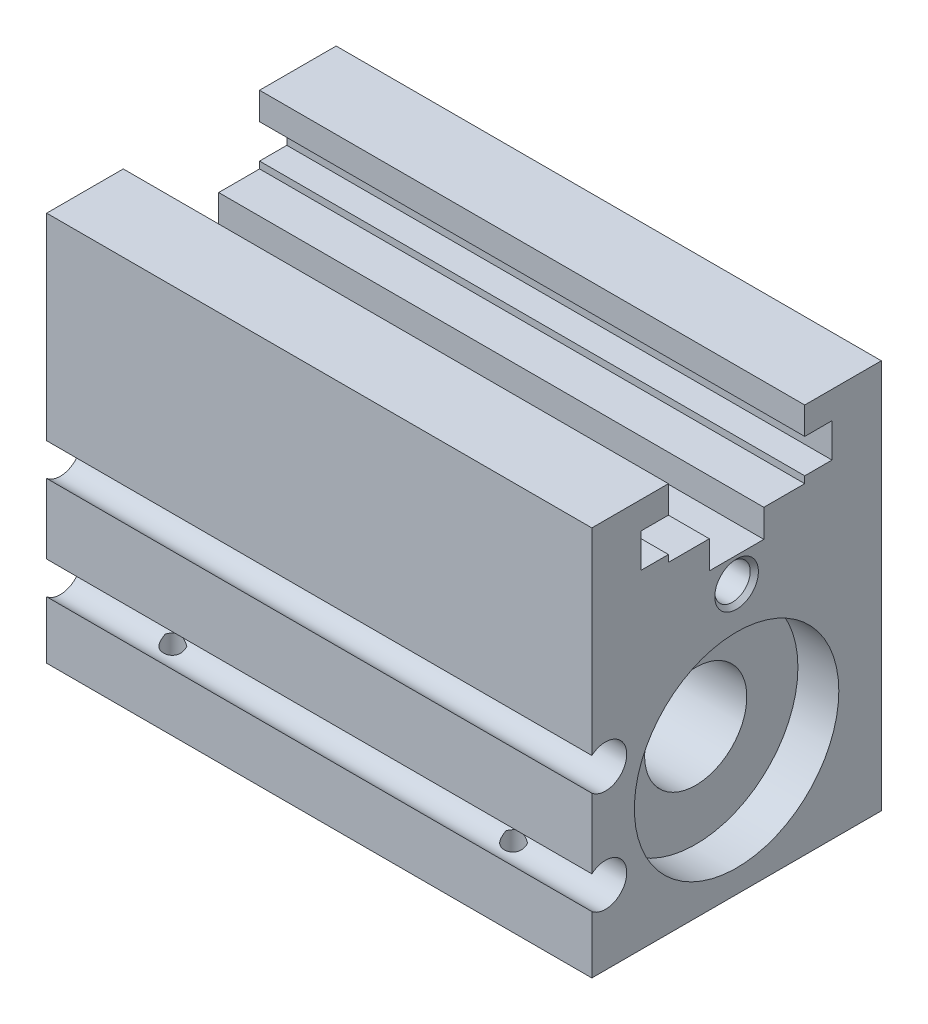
SolidWorks part; units mm, degrees
ref_plane "Front Plane" through (0, 0, 0) normal (0, 0, 1) x (1, 0, 0)
ref_plane "Top Plane" through (0, 0, 0) normal (0, 1, 0) x (1, 0, 0)
ref_plane "Right Plane" through (0, 0, 0) normal (1, 0, 0) x (0, 0, -1)
sketch "Sketch1" plane through (0, 0, 0) normal (1, 0, 0) x (0, 0, -1)
  line L0 (-13.4874, -18.161) -> (13.4874, -18.161)
  line L1 (13.4874, -18.161) -> (13.4874, 18.161)
  line L2 (13.4874, 18.161) -> (6.35, 18.161)
  line L3 (6.35, 18.161) -> (6.35, 15.621)
  line L4 (6.35, 15.621) -> (8.89, 15.621)
  line L5 (8.89, 15.621) -> (8.89, 12.446)
  line L6 (8.89, 12.446) -> (6.35, 12.446)
  line L7 (6.35, 12.446) -> (6.35, 11.811)
  line L8 (6.35, 11.811) -> (2.54, 11.811)
  line L9 (2.54, 11.811) -> (2.54, 9.2202)
  line L10 (2.54, 9.2202) -> (-2.54, 9.2202)
  line L11 (-2.54, 9.2202) -> (-2.54, 11.811)
  line L12 (-2.54, 11.811) -> (-6.35, 11.811)
  line L13 (-6.35, 11.811) -> (-6.35, 12.446)
  line L14 (-6.35, 12.446) -> (-8.89, 12.446)
  line L15 (-8.89, 12.446) -> (-8.89, 15.621)
  line L16 (-8.89, 15.621) -> (-6.35, 15.621)
  line L17 (-6.35, 15.621) -> (-6.35, 18.161)
  line L18 (-6.35, 18.161) -> (-13.4874, 18.161)
  line L19 (-13.4874, 18.161) -> (-13.4874, -0.2066)
  line L20 (-13.4874, -3.2478) -> (-13.4874, -9.757)
  line L21 (-13.4874, -12.7982) -> (-13.4874, -18.161)
  arc A0 (-13.4874, -0.2066) -> (-13.4874, -3.2478) centre (-12.2174, -1.7272) cw
  arc A1 (-13.4874, -9.757) -> (-13.4874, -12.7982) centre (-12.2174, -11.2776) cw
extrude "Extrude1" add sketch "Sketch1" along normal blind 50.8
ref_plane "Plane1" through (50.8, 0, 0) normal (1, 0, 0) x (0, 0, -1)
sketch "Sketch2" plane through (50.8, 0, 0) normal (1, 0, 0) x (0, 0, -1)
  circle A0 centre (0, -6.5024) radius 9.525
extrude "Cut-Extrude1" cut sketch "Sketch2" against normal blind 3.81
sketch "Sketch3" plane through (0, 0, 0) normal (1, 0, 0) x (0, 0, -1)
  circle A0 centre (10.3251, 8.4582) radius 1.2027
extrude "Cut-Extrude2" cut sketch "Sketch3" along normal blind 3.048
sketch "Sketch4" plane through (0, 0, 0) normal (1, 0, 0) x (0, 0, -1)
  circle A0 centre (-10.3251, -15.367) radius 1.2027
extrude "Cut-Extrude3" cut sketch "Sketch4" along normal blind 3.048
ref_plane "Plane2" through (0, 0, 10.3251) normal (0, 0, 1) x (1, 0, 0)
sketch "Sketch5" plane through (0, 0, 10.3251) normal (0, 0, 1) x (1, 0, 0)
  line L0 (0, 8.4582) -> (0, 9.8552)
  line L1 (0, 9.8552) -> (0.381, 9.4742)
  line L2 (0.381, 9.4742) -> (6.2714, 9.4742)
  line L3 (6.2714, 9.4742) -> (6.858, 8.4582)
  line L4 (6.858, 8.4582) -> (0, 8.4582)
  line L5 (6.858, 8.4582) -> (0, 8.4582) construction
revolve "Cut-Revolve1" cut sketch "Sketch5" angle 360 about L5
ref_plane "Plane3" through (0, 0, -10.3251) normal (0, 0, 1) x (1, 0, 0)
sketch "Sketch6" plane through (0, 0, -10.3251) normal (0, 0, 1) x (1, 0, 0)
  line L0 (0, -15.367) -> (0, -13.97)
  line L1 (0, -13.97) -> (0.381, -14.351)
  line L2 (0.381, -14.351) -> (6.2714, -14.351)
  line L3 (6.2714, -14.351) -> (6.858, -15.367)
  line L4 (6.858, -15.367) -> (0, -15.367)
  line L5 (6.858, -15.367) -> (0, -15.367) construction
revolve "Cut-Revolve2" cut sketch "Sketch6" angle 360 about L5
ref_plane "Plane4" through (5.715, 0, 0) normal (1, 0, 0) x (0, 0, -1)
sketch "Sketch7" plane through (5.715, 0, 0) normal (1, 0, 0) x (0, 0, -1)
  line L0 (8.9154, 3.8862) -> (8.9154, 5.8293)
  line L1 (8.9154, 5.8293) -> (13.0175, 5.8293)
  line L2 (13.0175, 5.8293) -> (13.4874, 6.2992)
  line L3 (13.4874, 6.2992) -> (13.4874, 3.8862)
  line L4 (13.4874, 3.8862) -> (8.9154, 3.8862)
  line L5 (13.4874, 3.8862) -> (8.9154, 3.8862) construction
revolve "Cut-Revolve3" cut sketch "Sketch7" angle 360 about L5
ref_plane "Plane5" through (43.4975, 0, 0) normal (1, 0, 0) x (0, 0, -1)
sketch "Sketch8" plane through (43.4975, 0, 0) normal (1, 0, 0) x (0, 0, -1)
  line L0 (8.9154, 3.8862) -> (8.9154, 5.8293)
  line L1 (8.9154, 5.8293) -> (13.0175, 5.8293)
  line L2 (13.0175, 5.8293) -> (13.4874, 6.2992)
  line L3 (13.4874, 6.2992) -> (13.4874, 3.8862)
  line L4 (13.4874, 3.8862) -> (8.9154, 3.8862)
  line L5 (13.4874, 3.8862) -> (8.9154, 3.8862) construction
revolve "Cut-Revolve4" cut sketch "Sketch8" angle 360 about L5
sketch "Sketch9" plane through (0, 0, 0) normal (1, 0, 0) x (0, 0, -1)
  circle A0 centre (0, -6.5024) radius 9.525
extrude "Cut-Extrude4" cut sketch "Sketch9" along normal blind 3.81
sketch "Sketch10" plane through (0, 0, 0) normal (0, 0, 1) x (1, 0, 0)
  line L0 (0, -6.5024) -> (0, 2.8321)
  line L1 (0, 2.8321) -> (3.81, 2.8321)
  line L2 (3.81, 2.8321) -> (3.81, -6.5024)
  line L3 (3.81, -6.5024) -> (0, -6.5024)
  line L4 (3.81, -6.5024) -> (0, -6.5024) construction
revolve "Revolve1" add sketch "Sketch10" angle 360 about L4
ref_plane "Plane6" through (9.525, 0, 0) normal (1, 0, 0) x (0, 0, -1)
sketch "Sketch11" plane through (9.525, 0, 0) normal (1, 0, 0) x (0, 0, -1)
  line L0 (-11.1125, -18.161) -> (-12.5095, -18.161)
  line L1 (-12.5095, -18.161) -> (-12.1285, -17.78)
  line L2 (-12.1285, -17.78) -> (-12.1285, -12.804)
  line L3 (-12.1285, -12.804) -> (-11.1125, -12.2174)
  line L4 (-11.1125, -12.2174) -> (-11.1125, -18.161)
  line L5 (-11.1125, -12.2174) -> (-11.1125, -18.161) construction
revolve "Cut-Revolve5" cut sketch "Sketch11" angle 360 about L5
ref_plane "Plane7" through (0, -18.161, 0) normal (0, 1, 0) x (-1, 0, 0)
ref_plane "Plane8" through (41.275, 0, 0) normal (1, 0, 0) x (0, 0, -1)
ref_plane "Plane9" through (41.275, 0, 0) normal (1, 0, 0) x (0, 0, -1)
ref_plane "Plane10" through (9.525, 0, 0) normal (1, 0, 0) x (0, 0, -1)
sketch "Sketch12" plane through (41.275, 0, 0) normal (1, 0, 0) x (0, 0, -1)
  line L0 (-11.1125, -18.161) -> (-12.5095, -18.161)
  line L1 (-12.5095, -18.161) -> (-12.1285, -17.78)
  line L2 (-12.1285, -17.78) -> (-12.1285, -12.804)
  line L3 (-12.1285, -12.804) -> (-11.1125, -12.2174)
  line L4 (-11.1125, -12.2174) -> (-11.1125, -18.161)
  line L5 (-11.1125, -12.2174) -> (-11.1125, -18.161) construction
sketch "Sketch13" plane through (41.275, 0, 0) normal (1, 0, 0) x (0, 0, -1)
  line L0 (11.1125, -18.161) -> (9.7155, -18.161)
  line L1 (9.7155, -18.161) -> (10.0965, -17.78)
  line L2 (10.0965, -17.78) -> (10.0965, -12.804)
  line L3 (10.0965, -12.804) -> (11.1125, -12.2174)
  line L4 (11.1125, -12.2174) -> (11.1125, -18.161)
  line L5 (11.1125, -12.2174) -> (11.1125, -18.161) construction
sketch "Sketch14" plane through (9.525, 0, 0) normal (1, 0, 0) x (0, 0, -1)
  line L0 (11.1125, -18.161) -> (9.7155, -18.161)
  line L1 (9.7155, -18.161) -> (10.0965, -17.78)
  line L2 (10.0965, -17.78) -> (10.0965, -12.804)
  line L3 (10.0965, -12.804) -> (11.1125, -12.2174)
  line L4 (11.1125, -12.2174) -> (11.1125, -18.161)
  line L5 (11.1125, -12.2174) -> (11.1125, -18.161) construction
revolve "Cut-Revolve6" cut sketch "Sketch12" angle 360 about L5
revolve "Cut-Revolve7" cut sketch "Sketch13" angle 360 about L5
revolve "Cut-Revolve8" cut sketch "Sketch14" angle 360 about L5
sketch "Sketch15" plane through (0, -18.161, 0) normal (0, 1, 0) x (-1, 0, 0)
  circle A0 centre (-15.875, 11.1125) radius 1.2027
extrude "Cut-Extrude5" cut sketch "Sketch15" along normal blind 3.175
sketch "Sketch16" plane through (0, -18.161, 0) normal (0, 1, 0) x (-1, 0, 0)
  circle A0 centre (-34.925, 11.1125) radius 1.2027
sketch "Sketch17" plane through (0, -18.161, 0) normal (0, 1, 0) x (-1, 0, 0)
  circle A0 centre (-34.925, -11.1125) radius 1.2027
sketch "Sketch18" plane through (0, -18.161, 0) normal (0, 1, 0) x (-1, 0, 0)
  circle A0 centre (-15.875, -11.1125) radius 1.2027
extrude "Cut-Extrude6" cut sketch "Sketch16" along normal blind 3.175
extrude "Cut-Extrude7" cut sketch "Sketch17" along normal blind 3.175
extrude "Cut-Extrude8" cut sketch "Sketch18" along normal blind 3.175
sketch "Sketch19" plane through (0, 0, 0) normal (0, 0, 1) x (1, 0, 0)
  line L0 (0, 5.3609) -> (0, 7.3929)
  line L1 (0, 7.3929) -> (0.381, 7.0119)
  line L2 (0.381, 7.0119) -> (3.048, 7.0119)
  line L3 (3.048, 7.0119) -> (3.048, 5.3609)
  line L4 (3.048, 5.3609) -> (0, 5.3609)
  line L5 (3.048, 5.3609) -> (0, 5.3609) construction
revolve "Cut-Revolve9" cut sketch "Sketch19" angle 360 about L5
sketch "Sketch20" plane through (0, 0, 0) normal (0, 0, 1) x (1, 0, 0)
  line L0 (6.35, -6.5024) -> (6.35, -1.7399)
  line L1 (6.35, -1.7399) -> (46.99, -1.7399)
  line L2 (46.99, -1.7399) -> (46.99, -6.5024)
  line L3 (46.99, -6.5024) -> (6.35, -6.5024)
  line L4 (46.99, -6.5024) -> (6.35, -6.5024) construction
revolve "Cut-Revolve10" cut sketch "Sketch20" angle 360 about L4
sketch "Sketch21" plane through (0, 0, 0) normal (0, 0, 1) x (1, 0, 0)
  line L0 (47.752, 6.8834) -> (47.752, 8.5344)
  line L1 (47.752, 8.5344) -> (50.419, 8.5344)
  line L2 (50.419, 8.5344) -> (50.8, 8.9154)
  line L3 (50.8, 8.9154) -> (50.8, 6.8834)
  line L4 (50.8, 6.8834) -> (47.752, 6.8834)
  line L5 (50.8, 6.8834) -> (47.752, 6.8834) construction
revolve "Cut-Revolve11" cut sketch "Sketch21" angle 360 about L5
ref_plane "Plane11" through (50.8025, 0, 0) normal (1, 0, 0) x (0, 0, -1)
ref_plane "Plane12" through (50.8, 0, 0) normal (1, 0, 0) x (0, 0, -1)
ref_plane "Plane13" through (25.5016, 0, 0) normal (1, 0, 0) x (0, 0, -1)
